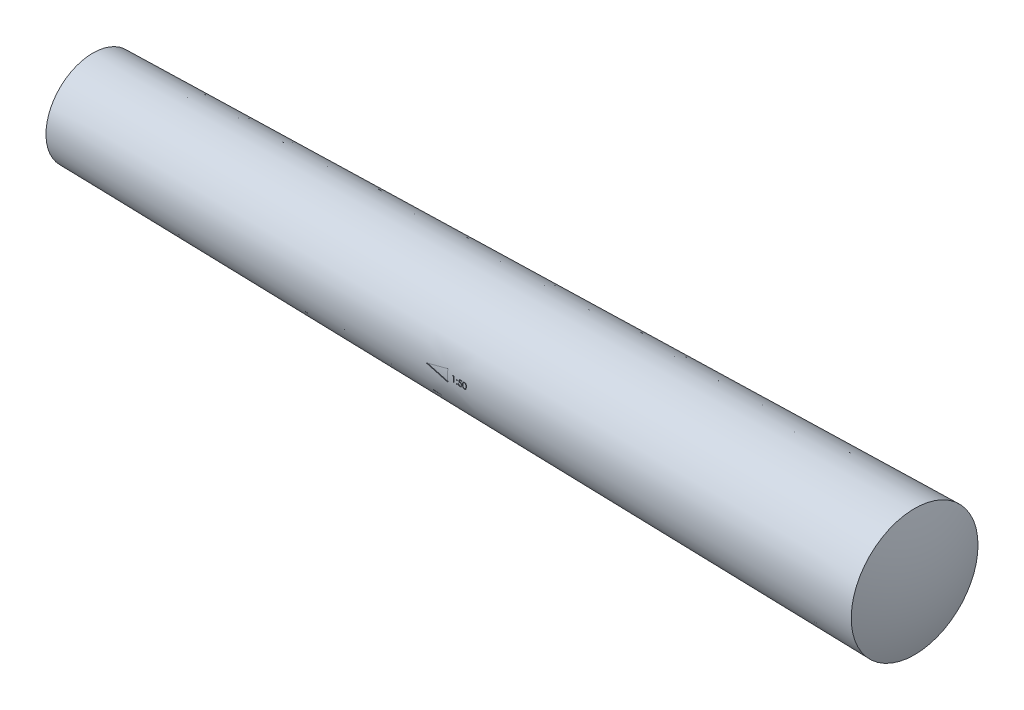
SolidWorks part; units mm, degrees
ref_plane "Front Plane" through (0, 0, 0) normal (0, 0, 1) x (1, 0, 0)
ref_plane "Top Plane" through (0, 0, 0) normal (0, 1, 0) x (1, 0, 0)
ref_plane "Right Plane" through (0, 0, 0) normal (1, 0, 0) x (0, 0, -1)
sketch "Sketch1" plane through (0, 0, 0) normal (1, 0, 0) x (0, 0, -1)
  circle A0 centre (0, 0) radius 8
  dimension "D1" = 16
extrude "Extrude1" add sketch "Sketch1" along normal mid plane 140
draft "Draft1" type of draft neutral plane draft angle 1.146 faces to draft 1 parameters "D1"=1.146
sketch "Sketch2" plane through (0, 0, 0) normal (0, 0, 1) x (1, 0, 0)
  line L0 (-70, 0) -> (-70, 8)
  line L1 (-70, 8) -> (-70, -8) construction
  line L2 (-70, 0) -> (-72, 0)
  line L3 (-72, 0) -> (-72, -9.4) construction
  line L4 (70, 0) -> (70, 10.8001)
  line L5 (70, -10.8001) -> (70, 10.8001) construction
  line L6 (70, 0) -> (72, 0)
  line L7 (72, 0) -> (72, -9.4) construction
  line L8 (-70, -8) -> (70, -10.8001) construction
  arc A0 (-72, 0) -> (-70, 8) centre (-55, 0) cw
  arc A1 (72, 0) -> (70, 10.8001) centre (41.8395, 0) ccw
  point P14 (0, -9.4)
revolve "Revolve1" add sketch "Sketch2" angle 360 about L2
sketch "Sketch5" plane through (0, 0, 0) normal (0, 0, 1) x (1, 0, 0)
  line L0 (0, 9.4) -> (0, -9.4) construction
  line L1 (70, 10.8001) -> (-70, 8) construction
  line L2 (-70, -8) -> (70, -10.8001) construction
ref_plane "Plane2" through (0, 0, 0) normal (-0.02, 0, 0.9998) x (0.9998, 0, 0.02)
sketch "Sketch6" plane through (0, 0, 0) normal (-0.02, 0, 0.9998) x (0.9998, 0, 0.02)
  line L0 (0, 0) -> (0, 1)
  line L1 (0, 9.4) -> (0, -9.4) construction
  line L2 (0, 1) -> (-3.7321, 0)
  line L3 (-3.7321, 0) -> (0, -1)
  line L4 (0, -1) -> (0, 0)
  line L5 (0, -0.5) -> (4, -0.5) construction
  text T0 "1:50" font "Century Gothic" height 1
  dimension "D1" = 2
  dimension "D2" = 30
  dimension "D3" = 4
wrap "Wrap2" sketch "Sketch6" wrap type deboss source sketch "Sketch6" thickness 0.1 parameters "D1"=0.1
equation "\"D2@Sketch2\" = \"D1@Sketch2\""
